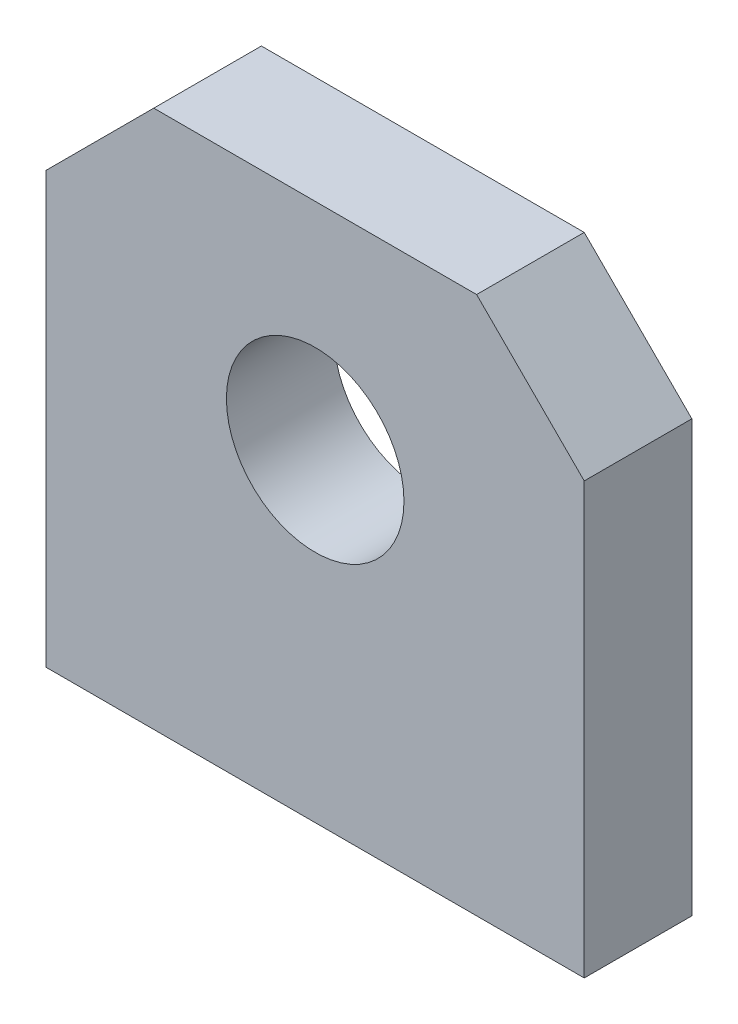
SolidWorks part; units mm, degrees
ref_plane "Plan de face" through (0, 0, 0) normal (0, 0, 1) x (1, 0, 0)
ref_plane "Plan de dessus" through (0, 0, 0) normal (0, 1, 0) x (1, 0, 0)
ref_plane "Plan de droite" through (0, 0, 0) normal (1, 0, 0) x (0, 0, -1)
sketch "Esquisse1" plane through (0, 0, 0) normal (0, 0, 1) x (1, 0, 0)
  line L1 (0, 0) -> (50, 0)
  line L2 (0, 0) -> (0, 50)
  line L3 (0, 50) -> (50, 50)
  line L4 (50, 0) -> (50, 50)
  circle A0 centre (25, 30) radius 8.25
  dimension "D3" = 16.5
  dimension "D1" = 50
  dimension "D2" = 50
  dimension "D4" = 30
  dimension "D5" = 25
extrude "Boss.-Extru.1" add sketch "Esquisse1" along normal blind 10
chamfer "Chanfrein1" distance 10 angle 45 2 edges at (0, 50, 5) (50, 50, 5)
